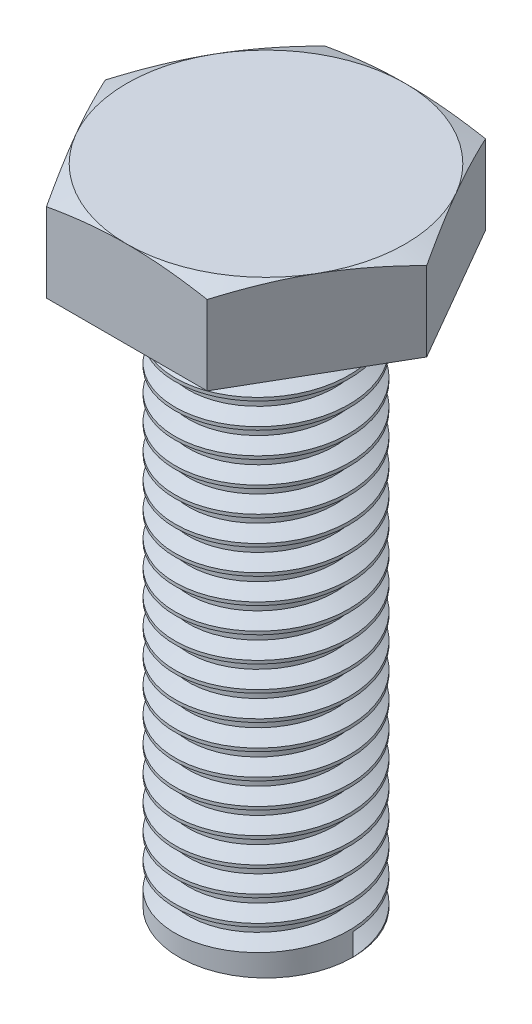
SolidWorks part; units mm, degrees
ref_plane "Front Plane" through (0, 0, 0) normal (0, 0, 1) x (1, 0, 0)
ref_plane "Top Plane" through (0, 0, 0) normal (0, 1, 0) x (1, 0, 0)
ref_plane "Right Plane" through (0, 0, 0) normal (1, 0, 0) x (0, 0, -1)
sketch "Sketch1" plane through (0, 0, 0) normal (0, 1, 0) x (1, 0, 0)
  circle A0 centre (0, 0) radius 7.9375
  dimension "D1" = 15.875
extrude "Boss-Extrude1" add sketch "Sketch1" along normal blind 50.8
sketch "Sketch2" plane through (0, 50.8, 0) normal (0, 1, 0) x (1, 0, 0)
  line L1 (14.6647, 0) -> (7.3323, 12.7)
  line L2 (7.3323, 12.7) -> (-7.3323, 12.7)
  line L3 (-7.3323, 12.7) -> (-14.6647, 0)
  line L4 (-14.6647, 0) -> (-7.3323, -12.7)
  line L5 (-7.3323, -12.7) -> (7.3323, -12.7)
  line L6 (7.3323, -12.7) -> (14.6647, 0)
  circle A0 centre (0, 0) radius 12.7 construction
extrude "Boss-Extrude2" add sketch "Sketch2" along normal blind 7.9375
sketch "Sketch3" plane through (0, 0, 0) normal (1, 0, 0) x (0, 0, -1)
  line L0 (-12.7, 58.7375) -> (-22.8666, 58.7375)
  line L1 (-22.8666, 58.7375) -> (-22.8666, 55.0372)
  line L2 (-22.8666, 55.0372) -> (-12.7, 58.7375)
  line L3 (0, 58.7375) -> (0, 60.1306) construction
  dimension "D1" = 20
revolve "Cut-Revolve1" cut sketch "Sketch3" angle 360 about L3
thread "Thread1" pitch 2.3091 start angle 0, offset 0, length 50.8, pitch 2.3091, diameter 15.875
ref_plane "Plane1" through (7.9375, 0, 0) normal (0, 0, 1) x (1, 0, 0)
sketch "Thread Profile1" plane through (7.9375, 0, 0) normal (0, 0, 1) x (1, 0, 0)
  line L0 (0, 0) -> (0, 2.3091) construction
  line L11 (0, 0) -> (0, 2.0205)
  line L12 (0, 2.0205) -> (-1.2498, 1.2989)
  line L13 (-1.2498, 1.2989) -> (-1.2498, 0.7216)
  line L15 (-1.2498, 0.7216) -> (0, 0)
  line L17 (-1.2498, 1.0102) -> (0, 1.0102) construction
  point P2 (0, 0)
  dimension "Pitch" = 2.3091
  dimension "Profile_Angle" = 60
  dimension "Profile_Land" = 0.5773
  dimension "Profile_Height" = 1.2498
